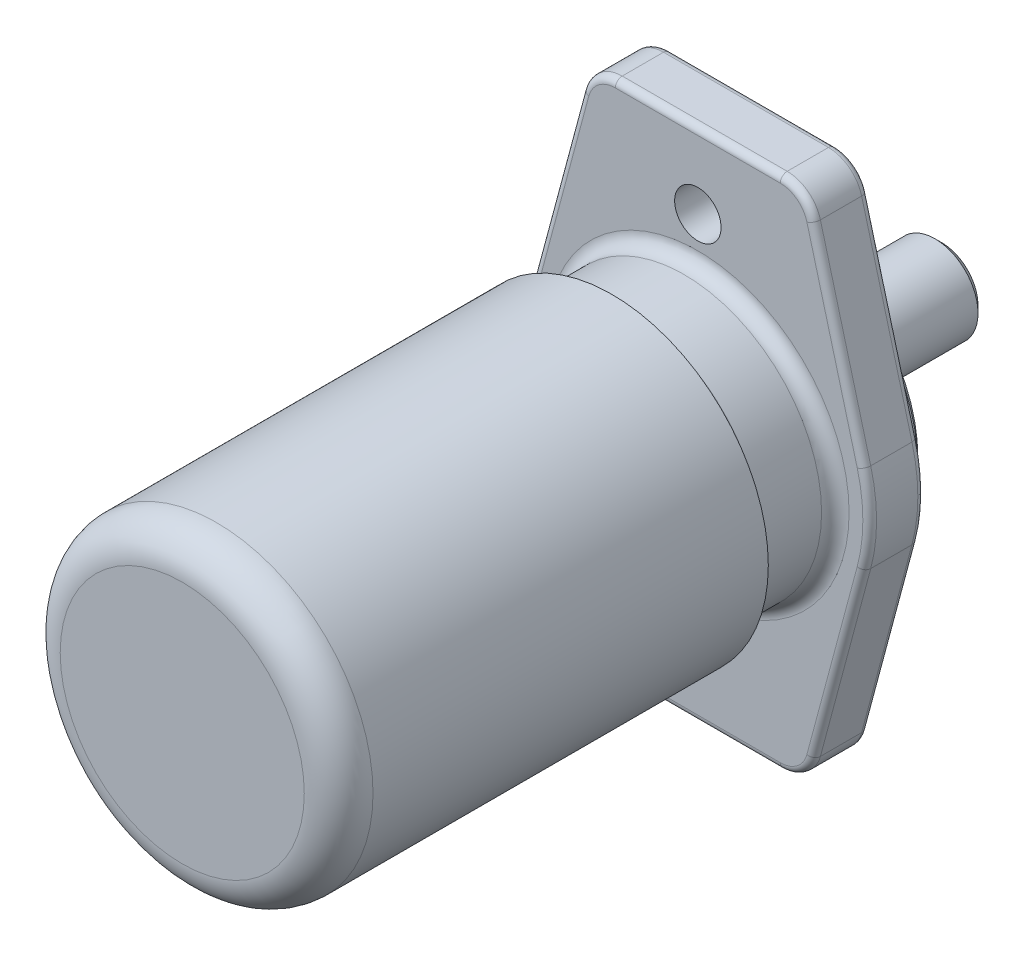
SolidWorks part; units mm, degrees
ref_plane "Face" through (0, 0, 0) normal (0, 0, 1) x (1, 0, 0)
ref_plane "Dessus" through (0, 0, 0) normal (0, 1, 0) x (1, 0, 0)
ref_plane "Droite" through (0, 0, 0) normal (1, 0, 0) x (0, 0, -1)
sketch "Esquisse1" plane through (0, 0, 0) normal (0, 0, 1) x (1, 0, 0)
  circle A0 centre (0, 0) radius 42
  dimension "D1" = 84
extrude "Base-Extrusion" add sketch "Esquisse1" along normal blind 8
sketch "Esquisse2" plane through (0, 0, 8) normal (0, 0, 1) x (1, 0, 0)
  line L0 (-23.9943, 75) -> (23.9943, 75)
  line L1 (-23.9943, -75) -> (23.9943, -75)
  line L2 (48.2963, -12.941) -> (33.6536, -67.5882)
  line L3 (-48.2963, -12.941) -> (-33.6536, -67.5882)
  line L4 (-48.2963, 12.941) -> (-33.6536, 67.5882)
  line L5 (33.6536, 67.5882) -> (48.2963, 12.941)
  arc A0 (48.2963, -12.941) -> (48.2963, 12.941) centre (0, 0) ccw
  arc A1 (-48.2963, 12.941) -> (-48.2963, -12.941) centre (0, 0) ccw
  arc A2 (-23.9943, 75) -> (-33.6536, 67.5882) centre (-23.9943, 65) ccw
  arc A3 (33.6536, 67.5882) -> (23.9943, 75) centre (23.9943, 65) ccw
  arc A4 (23.9943, -75) -> (33.6536, -67.5882) centre (23.9943, -65) ccw
  arc A5 (-33.6536, -67.5882) -> (-23.9943, -75) centre (-23.9943, -65) ccw
  circle A6 centre (0, 53.2) radius 6.75
  circle A7 centre (0, -53.2) radius 6.75
  dimension "D1" = 100
  dimension "D6" = 10
  dimension "D7" = 13.5
  dimension "D2" = 75
  dimension "D3" = 75
  dimension "D4" = 30
  dimension "D5" = 105
  dimension "D8" = 53.2
  dimension "D9" = 53.2
extrude "Boss.-Extru.1" add sketch "Esquisse2" along normal blind 16
sketch "Esquisse3" plane through (0, 0, 0) normal (0, 0, -1) x (-1, 0, 0)
  circle A0 centre (0, 0) radius 12.5
  dimension "D1" = 25
extrude "Boss.-Extru.2" add sketch "Esquisse3" along normal blind 47
sketch "Esquisse4" plane through (0, 0, 24) normal (0, 0, 1) x (1, 0, 0)
  circle A0 centre (0, 0) radius 40
  dimension "D1" = 80
extrude "Boss.-Extru.3" add sketch "Esquisse4" along normal blind 25
sketch "Esquisse5" plane through (0, 0, 49) normal (0, 0, 1) x (1, 0, 0)
  circle A0 centre (0, 0) radius 45.5
  dimension "D1" = 91
extrude "Boss.-Extru.4" add sketch "Esquisse5" along normal blind 125
fillet "Congé1" radius 10
fillet "Congé2" radius 4
fillet "Congé3" radius 2
chamfer "Chanfrein1" distance 2 angle 45
